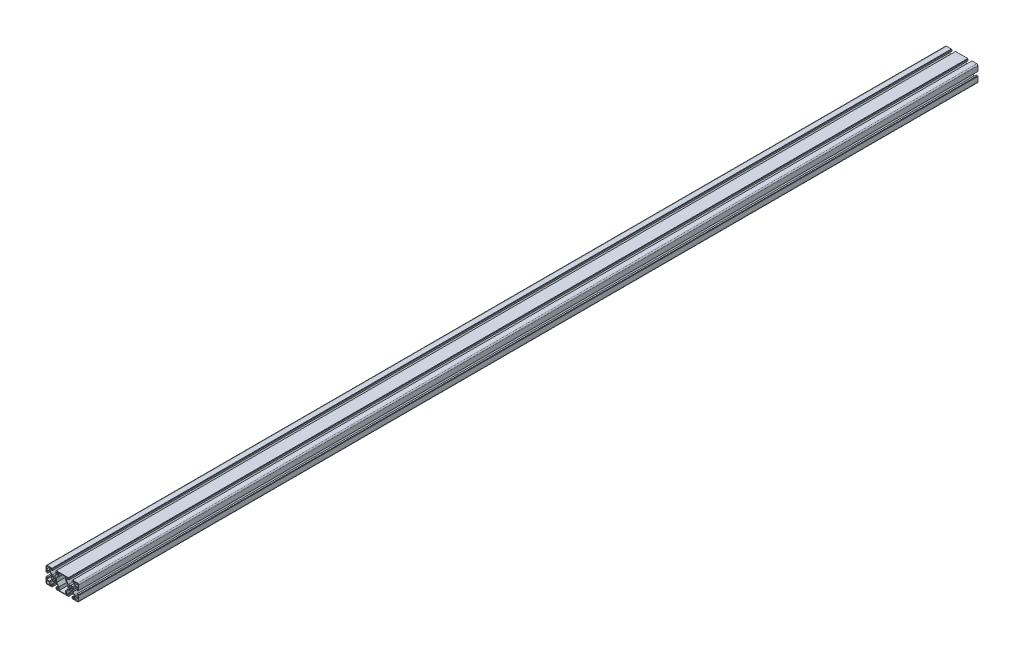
SolidWorks part; units mm, degrees
ref_plane "Спереди" through (0, 0, 0) normal (0, 0, 1) x (1, 0, 0)
ref_plane "Сверху" through (0, 0, 0) normal (0, 1, 0) x (1, 0, 0)
ref_plane "Справа" through (0, 0, 0) normal (1, 0, 0) x (0, 0, -1)
sketch "Эскиз1" plane through (0, 0, 0) normal (0, 0, 1) x (1, 0, 0)
  line L0 (36.8681, -20.9235) -> (24.9681, -20.9235)
  line L1 (39.8681, -6.0235) -> (39.8681, -17.9235)
  line L2 (39.8681, -6.0235) -> (38.8628, -6.0235)
  line L3 (38.8628, -6.0235) -> (38.8628, -5.0235)
  line L4 (38.8628, -5.0235) -> (35.4628, -5.0235)
  line L5 (35.4628, -5.0235) -> (35.4628, -7.3235)
  line L6 (35.4628, -7.3235) -> (38.1628, -7.3235)
  line L7 (38.1628, -7.3235) -> (38.1628, -11.1794)
  line L8 (38.1628, -11.1794) -> (31.3864, -11.1794)
  line L9 (25.8628, -5.6554) -> (31.3864, -11.1794)
  line L10 (25.8628, -1.4176) -> (25.8628, -5.6554)
  line L11 (25.3716, -0.9264) -> (25.8628, -1.4176)
  line L12 (25.3716, -0.9264) -> (25.8628, -0.4352)
  line L13 (25.8628, 3.8026) -> (25.8628, -0.4352)
  line L14 (31.3853, 9.3227) -> (25.8628, 3.8026)
  line L15 (38.1628, 9.3227) -> (31.3853, 9.3227)
  line L16 (38.1628, 5.4786) -> (38.1628, 9.3227)
  line L17 (35.4628, 5.4786) -> (38.1628, 5.4786)
  line L18 (35.4628, 3.1786) -> (35.4628, 5.4786)
  line L19 (38.8628, 3.1786) -> (35.4628, 3.1786)
  line L20 (38.8628, 4.1786) -> (38.8628, 3.1786)
  line L21 (39.8681, 4.1786) -> (38.8628, 4.1786)
  line L22 (39.8681, 16.0765) -> (39.8681, 4.1786)
  line L23 (24.9681, 19.0765) -> (36.8681, 19.0765)
  line L24 (24.9681, 19.0765) -> (24.9681, 18.0765)
  line L25 (24.9681, 18.0765) -> (23.9681, 18.0765)
  line L26 (23.9681, 18.0765) -> (23.9681, 14.6765)
  line L27 (23.9681, 14.6765) -> (26.2681, 14.6765)
  line L28 (26.2681, 14.6765) -> (26.2681, 17.3765)
  line L29 (26.2681, 17.3765) -> (30.1167, 17.3765)
  line L30 (30.1167, 17.3765) -> (30.1167, 10.6103)
  line L31 (30.1167, 10.6103) -> (24.5851, 5.0726)
  line L32 (20.3558, 5.0726) -> (24.5851, 5.0726)
  line L33 (19.8603, 4.5771) -> (20.3558, 5.0726)
  line L34 (19.8603, 4.5771) -> (19.3649, 5.0726)
  line L35 (15.1356, 5.0726) -> (19.3649, 5.0726)
  line L36 (9.62, 10.591) -> (15.1356, 5.0726)
  line L37 (9.62, 17.3765) -> (9.62, 10.591)
  line L38 (13.4681, 17.3765) -> (9.62, 17.3765)
  line L39 (13.4681, 14.6765) -> (13.4681, 17.3765)
  line L40 (15.7681, 14.6765) -> (13.4681, 14.6765)
  line L41 (15.7681, 18.0765) -> (15.7681, 14.6765)
  line L42 (14.7681, 18.0765) -> (15.7681, 18.0765)
  line L43 (14.7681, 19.0765) -> (14.7681, 18.0765)
  line L44 (-15.0319, 19.0765) -> (14.7681, 19.0765)
  line L45 (-15.0319, 19.0765) -> (-15.0319, 18.0765)
  line L46 (-15.0319, 18.0765) -> (-16.0319, 18.0765)
  line L47 (-16.0319, 18.0765) -> (-16.0319, 14.6765)
  line L48 (-16.0319, 14.6765) -> (-13.7319, 14.6765)
  line L49 (-13.7319, 14.6765) -> (-13.7319, 17.3765)
  line L50 (-13.7319, 17.3765) -> (-9.8833, 17.3765)
  line L51 (-9.8833, 17.3765) -> (-9.8833, 10.6103)
  line L52 (-9.8833, 10.6103) -> (-15.4149, 5.0726)
  line L53 (-19.6442, 5.0726) -> (-15.4149, 5.0726)
  line L54 (-20.1397, 4.5771) -> (-19.6442, 5.0726)
  line L55 (-20.1397, 4.5771) -> (-20.6351, 5.0726)
  line L56 (-24.8644, 5.0726) -> (-20.6351, 5.0726)
  line L57 (-30.38, 10.591) -> (-24.8644, 5.0726)
  line L58 (-30.38, 17.3765) -> (-30.38, 10.591)
  line L59 (-26.5319, 17.3765) -> (-30.38, 17.3765)
  line L60 (-26.5319, 14.6765) -> (-26.5319, 17.3765)
  line L61 (-24.2319, 14.6765) -> (-26.5319, 14.6765)
  line L62 (-24.2319, 18.0765) -> (-24.2319, 14.6765)
  line L63 (-25.2319, 18.0765) -> (-24.2319, 18.0765)
  line L64 (-25.2319, 19.0765) -> (-25.2319, 18.0765)
  line L65 (-37.1319, 19.0765) -> (-25.2319, 19.0765)
  line L66 (-40.1319, 16.0765) -> (-40.1319, 4.1765)
  line L67 (-40.1319, 4.1765) -> (-39.1319, 4.1765)
  line L68 (-39.1319, 4.1765) -> (-39.1319, 3.1765)
  line L69 (-39.1319, 3.1765) -> (-35.7319, 3.1765)
  line L70 (-35.7319, 3.1765) -> (-35.7319, 5.4691)
  line L71 (-35.7319, 5.4691) -> (-38.4319, 5.4691)
  line L72 (-38.4319, 5.4691) -> (-38.4319, 9.3171)
  line L73 (-38.4319, 9.3171) -> (-31.6588, 9.3171)
  line L74 (-31.6588, 9.3171) -> (-26.1319, 3.7909)
  line L75 (-26.1319, 3.7909) -> (-26.1319, -0.4266)
  line L76 (-25.631, -0.9276) -> (-26.1319, -0.4266)
  line L77 (-25.631, -0.9276) -> (-26.1319, -1.4285)
  line L78 (-26.1319, -1.4285) -> (-26.1319, -5.646)
  line L79 (-26.1319, -5.646) -> (-31.6594, -11.1735)
  line L80 (-38.4319, -11.1735) -> (-31.6594, -11.1735)
  line L81 (-38.4319, -7.3235) -> (-38.4319, -11.1735)
  line L82 (-35.7319, -7.3235) -> (-38.4319, -7.3235)
  line L83 (-35.7319, -5.0235) -> (-35.7319, -7.3235)
  line L84 (-39.1319, -5.0235) -> (-35.7319, -5.0235)
  line L85 (-39.1319, -6.0235) -> (-39.1319, -5.0235)
  line L86 (-40.1319, -6.0235) -> (-39.1319, -6.0235)
  line L87 (-40.1319, -6.0235) -> (-40.1319, -17.9235)
  line L88 (-25.2319, -20.9235) -> (-37.1319, -20.9235)
  line L89 (-25.2319, -20.9235) -> (-25.2319, -19.9235)
  line L90 (-25.2319, -19.9235) -> (-24.2319, -19.9235)
  line L91 (-24.2319, -19.9235) -> (-24.2319, -16.5235)
  line L92 (-24.2319, -16.5235) -> (-26.5319, -16.5235)
  line L93 (-26.5319, -16.5235) -> (-26.5319, -19.2235)
  line L94 (-26.5319, -19.2235) -> (-30.3819, -19.2235)
  line L95 (-30.3819, -19.2235) -> (-30.3819, -12.4202)
  line L96 (-24.8697, -6.9274) -> (-30.3819, -12.4202)
  line L97 (-24.8697, -6.9274) -> (-20.6384, -6.9274)
  line L98 (-20.1398, -6.4289) -> (-20.6384, -6.9274)
  line L99 (-20.1398, -6.4289) -> (-19.6413, -6.9274)
  line L100 (-19.6413, -6.9274) -> (-15.41, -6.9274)
  line L101 (-15.41, -6.9274) -> (-9.8869, -12.446)
  line L102 (-9.8869, -19.2235) -> (-9.8869, -12.446)
  line L103 (-13.7319, -19.2235) -> (-9.8869, -19.2235)
  line L104 (-13.7319, -16.5235) -> (-13.7319, -19.2235)
  line L105 (-16.0319, -16.5235) -> (-13.7319, -16.5235)
  line L106 (-16.0319, -19.9235) -> (-16.0319, -16.5235)
  line L107 (-15.0319, -19.9235) -> (-16.0319, -19.9235)
  line L108 (-15.0319, -20.9235) -> (-15.0319, -19.9235)
  line L109 (-15.0319, -20.9235) -> (14.7681, -20.9235)
  line L110 (14.7681, -20.9235) -> (14.7681, -19.9235)
  line L111 (14.7681, -19.9235) -> (15.7681, -19.9235)
  line L112 (15.7681, -19.9235) -> (15.7681, -16.5235)
  line L113 (15.7681, -16.5235) -> (13.4681, -16.5235)
  line L114 (13.4681, -16.5235) -> (13.4681, -19.2235)
  line L115 (13.4681, -19.2235) -> (9.6181, -19.2235)
  line L116 (9.6181, -19.2235) -> (9.6181, -12.4202)
  line L117 (15.1303, -6.9274) -> (9.6181, -12.4202)
  line L118 (15.1303, -6.9274) -> (19.3616, -6.9274)
  line L119 (19.8602, -6.4289) -> (19.3616, -6.9274)
  line L120 (19.8602, -6.4289) -> (20.3587, -6.9274)
  line L121 (20.3587, -6.9274) -> (24.59, -6.9274)
  line L122 (24.59, -6.9274) -> (30.1131, -12.446)
  line L123 (30.1131, -19.2235) -> (30.1131, -12.446)
  line L124 (26.2681, -19.2235) -> (30.1131, -19.2235)
  line L125 (26.2681, -16.5235) -> (26.2681, -19.2235)
  line L126 (23.9681, -16.5235) -> (26.2681, -16.5235)
  line L127 (23.9681, -19.9235) -> (23.9681, -16.5235)
  line L128 (24.9681, -19.9235) -> (23.9681, -19.9235)
  line L129 (24.9681, -20.9235) -> (24.9681, -19.9235)
  line L130 (18.2819, -3.9324) -> (17.221, -4.9933)
  line L131 (15.8068, -4.2862) -> (16.5139, -4.9933)
  line L132 (16.8677, -2.5182) -> (15.8068, -3.5791)
  line L133 (15.8068, 1.7242) -> (16.8677, 0.6633)
  line L134 (16.5139, 3.1384) -> (15.8068, 2.4313)
  line L135 (17.221, 3.1384) -> (18.2819, 2.0775)
  line L136 (22.5243, 3.1384) -> (21.4634, 2.0775)
  line L137 (23.9385, 2.4313) -> (23.2314, 3.1384)
  line L138 (23.9385, 1.7242) -> (22.8776, 0.6633)
  line L139 (22.8776, -2.5182) -> (23.9385, -3.5791)
  line L140 (23.2314, -4.9933) -> (23.9385, -4.2862)
  line L141 (21.4634, -3.9324) -> (22.5243, -4.9933)
  line L142 (-37.1273, -19.7235) -> (-31.4773, -19.7235)
  line L143 (-38.9273, -17.9235) -> (-38.9273, -12.2735)
  line L144 (-31.4773, -12.2735) -> (-38.9273, -12.2735)
  line L145 (-31.4773, -12.2735) -> (-31.4773, -19.7235)
  line L146 (13.8328, -5.646) -> (7.8123, -11.6665)
  line L147 (7.8123, -11.6665) -> (7.8123, -19.6235)
  line L148 (-8.0926, -19.6235) -> (7.8123, -19.6235)
  line L149 (-8.0926, -11.7004) -> (-8.0926, -19.6235)
  line L150 (-14.1372, -5.6554) -> (-8.0926, -11.7004)
  line L151 (-14.1372, 3.8026) -> (-14.1372, -5.6554)
  line L152 (-8.0823, 9.8551) -> (-14.1372, 3.8026)
  line L153 (-8.0823, 17.7765) -> (-8.0823, 9.8551)
  line L154 (-8.0823, 17.7765) -> (7.8211, 17.7765)
  line L155 (7.8211, 17.7765) -> (7.8211, 9.8029)
  line L156 (7.8211, 9.8029) -> (13.8337, 3.7909)
  line L157 (13.8337, 3.7909) -> (13.8328, -5.646)
  line L158 (-38.9273, 16.0765) -> (-38.9273, 10.4245)
  line L159 (-37.1273, 17.8765) -> (-31.4754, 17.8765)
  line L160 (-31.4754, 10.4245) -> (-31.4754, 17.8765)
  line L161 (-31.4754, 10.4245) -> (-38.9273, 10.4245)
  line L162 (-17.4757, 3.1384) -> (-18.5366, 2.0775)
  line L163 (-16.0615, 2.4313) -> (-16.7686, 3.1384)
  line L164 (-16.0615, 1.7242) -> (-17.1224, 0.6633)
  line L165 (-17.1224, -2.5182) -> (-16.0615, -3.5791)
  line L166 (-16.7686, -4.9933) -> (-16.0615, -4.2862)
  line L167 (-18.5366, -3.9324) -> (-17.4757, -4.9933)
  line L168 (-21.7181, -3.9324) -> (-22.779, -4.9933)
  line L169 (-24.1932, -4.2862) -> (-23.4861, -4.9933)
  line L170 (-23.1323, -2.5182) -> (-24.1932, -3.5791)
  line L171 (-24.1932, 1.7242) -> (-23.1323, 0.6633)
  line L172 (-23.4861, 3.1384) -> (-24.1932, 2.4313)
  line L173 (-22.779, 3.1384) -> (-21.7181, 2.0775)
  line L174 (36.8727, -19.7235) -> (31.2207, -19.7235)
  line L175 (31.2207, -12.2794) -> (31.2207, -19.7235)
  line L176 (31.2207, -12.2794) -> (38.6727, -12.2794)
  line L177 (38.6727, -17.9235) -> (38.6727, -12.2794)
  line L178 (38.6727, 16.0765) -> (38.6727, 10.4206)
  line L179 (31.2246, 10.4206) -> (38.6727, 10.4206)
  line L180 (31.2246, 10.4206) -> (31.2246, 17.8765)
  line L181 (36.8727, 17.8765) -> (31.2246, 17.8765)
  arc A0 (36.8681, -20.9235) -> (39.8681, -17.9235) centre (36.8681, -17.9235) ccw
  arc A1 (39.8681, 16.0765) -> (36.8681, 19.0765) centre (36.8681, 16.0765) ccw
  arc A2 (-37.1319, 19.0765) -> (-40.1319, 16.0765) centre (-37.1319, 16.0765) ccw
  arc A3 (-40.1319, -17.9235) -> (-37.1319, -20.9235) centre (-37.1319, -17.9235) ccw
  arc A4 (18.2819, -3.9324) -> (21.4634, -3.9324) centre (19.8727, -0.9274) ccw
  arc A5 (16.5139, -4.9933) -> (17.221, -4.9933) centre (16.8675, -4.6398) ccw
  arc A6 (15.8068, -3.5791) -> (15.8068, -4.2862) centre (16.1603, -3.9327) ccw
  arc A7 (16.8677, 0.6633) -> (16.8677, -2.5182) centre (19.8727, -0.9274) ccw
  arc A8 (15.8068, 2.4313) -> (15.8068, 1.7242) centre (16.1603, 2.0778) ccw
  arc A9 (17.221, 3.1384) -> (16.5139, 3.1384) centre (16.8675, 2.7849) ccw
  arc A10 (21.4634, 2.0775) -> (18.2819, 2.0775) centre (19.8727, -0.9274) ccw
  arc A11 (23.2314, 3.1384) -> (22.5243, 3.1384) centre (22.8779, 2.7849) ccw
  arc A12 (23.9385, 1.7242) -> (23.9385, 2.4313) centre (23.585, 2.0778) ccw
  arc A13 (22.8776, -2.5182) -> (22.8776, 0.6633) centre (19.8727, -0.9274) ccw
  arc A14 (23.9385, -4.2862) -> (23.9385, -3.5791) centre (23.585, -3.9327) ccw
  arc A15 (22.5243, -4.9933) -> (23.2314, -4.9933) centre (22.8779, -4.6398) ccw
  arc A16 (-38.9273, -17.9235) -> (-37.1273, -19.7235) centre (-37.1273, -17.9235) ccw
  arc A17 (-37.1273, 17.8765) -> (-38.9273, 16.0765) centre (-37.1273, 16.0765) ccw
  arc A18 (-18.5366, 2.0775) -> (-21.7181, 2.0775) centre (-20.1273, -0.9274) ccw
  arc A19 (-16.7686, 3.1384) -> (-17.4757, 3.1384) centre (-17.1221, 2.7849) ccw
  arc A20 (-16.0615, 1.7242) -> (-16.0615, 2.4313) centre (-16.415, 2.0778) ccw
  arc A21 (-17.1224, -2.5182) -> (-17.1224, 0.6633) centre (-20.1273, -0.9274) ccw
  arc A22 (-16.0615, -4.2862) -> (-16.0615, -3.5791) centre (-16.415, -3.9327) ccw
  arc A23 (-17.4757, -4.9933) -> (-16.7686, -4.9933) centre (-17.1221, -4.6398) ccw
  arc A24 (-21.7181, -3.9324) -> (-18.5366, -3.9324) centre (-20.1273, -0.9274) ccw
  arc A25 (-23.4861, -4.9933) -> (-22.779, -4.9933) centre (-23.1325, -4.6398) ccw
  arc A26 (-24.1932, -3.5791) -> (-24.1932, -4.2862) centre (-23.8397, -3.9327) ccw
  arc A27 (-23.1323, 0.6633) -> (-23.1323, -2.5182) centre (-20.1273, -0.9274) ccw
  arc A28 (-24.1932, 2.4313) -> (-24.1932, 1.7242) centre (-23.8397, 2.0778) ccw
  arc A29 (-22.779, 3.1384) -> (-23.4861, 3.1384) centre (-23.1325, 2.7849) ccw
  arc A30 (36.8727, -19.7235) -> (38.6727, -17.9235) centre (36.8727, -17.9235) ccw
  arc A31 (38.6727, 16.0765) -> (36.8727, 17.8765) centre (36.8727, 16.0765) ccw
extrude "Бобышка-Вытянуть1" add sketch "Эскиз1" along normal blind 2200
hole_wizard "Диаметр отверстия Ø8.2 (8.2)1" positions "Эскиз2" profile "Эскиз3" hole size "Ø8.2" standard "ISO"
sketch "Эскиз2" plane through (0, -6.9274, 0) normal (0, -1, 0) x (-1, 0, 0)
  line L1 (20.1398, -2200) -> (20.1398, 0) construction
  point P0 (20.1398, -2190)
  point P5 (20.1398, -2060)
  point P21 (20.1398, -2040)
  point P22 (20.1398, -1910)
  point P23 (20.1398, -1890)
  point P24 (20.1398, -1760)
  dimension "D1" = 130
  dimension "D2" = 10
  dimension "D3" = 3
sketch "Эскиз3" plane through (-20.1398, -6.9274, 2190) normal (1, 0, 0) x (0, 0, -1)
  line L0 (0, 0) -> (0, 28.6635)
  line L1 (0, 28.6635) -> (4.1, 26.2)
  line L2 (4.1, 26.2) -> (4.1, 0)
  line L5 (4.1, 0) -> (0, 0)
  line L10 (0, 28.6635) -> (-4.1, 26.2) construction
  line L11 (0, -6.35) -> (0, 107.95) construction
  dimension "Диаметр отверстия" = 8.2
  dimension "Глубина отверстия" = 26.2
  dimension "Угол заточки сверла" = 118
hole_wizard "Диаметр отверстия Ø8.2 (8.2)2" positions "Эскиз4" profile "Эскиз5" hole size "Ø8.2" standard "ISO"
sketch "Эскиз4" plane through (-26.1319, 0, 0) normal (-1, 0, 0) x (0, 0, 1)
  line L0 (2200, -0.9276) -> (0, -0.9276) construction
  line L1 (2200, 3.7909) -> (2200, -0.4266) construction
  point P0 (2164.3, -0.9276)
  point P11 (214.3, -0.9276)
  dimension "D1" = 35.7
  dimension "D2" = 2
sketch "Эскиз5" plane through (-26.1319, -0.9276, 2164.3) normal (0, 1, 0) x (0, 0, 1)
  line L0 (0, 0) -> (0, 58.6635)
  line L1 (0, 58.6635) -> (4.1, 56.2)
  line L2 (4.1, 56.2) -> (4.1, 0)
  line L5 (4.1, 0) -> (0, 0)
  line L10 (0, 58.6635) -> (-4.1, 56.2) construction
  line L11 (0, -6.35) -> (0, 107.95) construction
  dimension "Диаметр отверстия" = 8.2
  dimension "Глубина отверстия" = 56.2
  dimension "Угол заточки сверла" = 118
